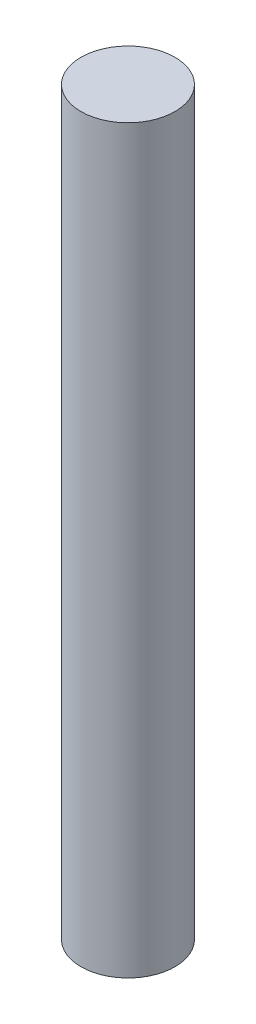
SolidWorks part; units mm, degrees
ref_plane "Front Plane" through (0, 0, 0) normal (0, 0, 1) x (1, 0, 0)
ref_plane "Top Plane" through (0, 0, 0) normal (0, 1, 0) x (1, 0, 0)
ref_plane "Right Plane" through (0, 0, 0) normal (1, 0, 0) x (0, 0, -1)
sketch "Sketch1" plane through (0, 0, 0) normal (0, 1, 0) x (1, 0, 0)
  circle A0 centre (0, 0) radius 6.35
  dimension "D1" = 12.7
extrude "Boss-Extrude1" add sketch "Sketch1" along normal blind 100
